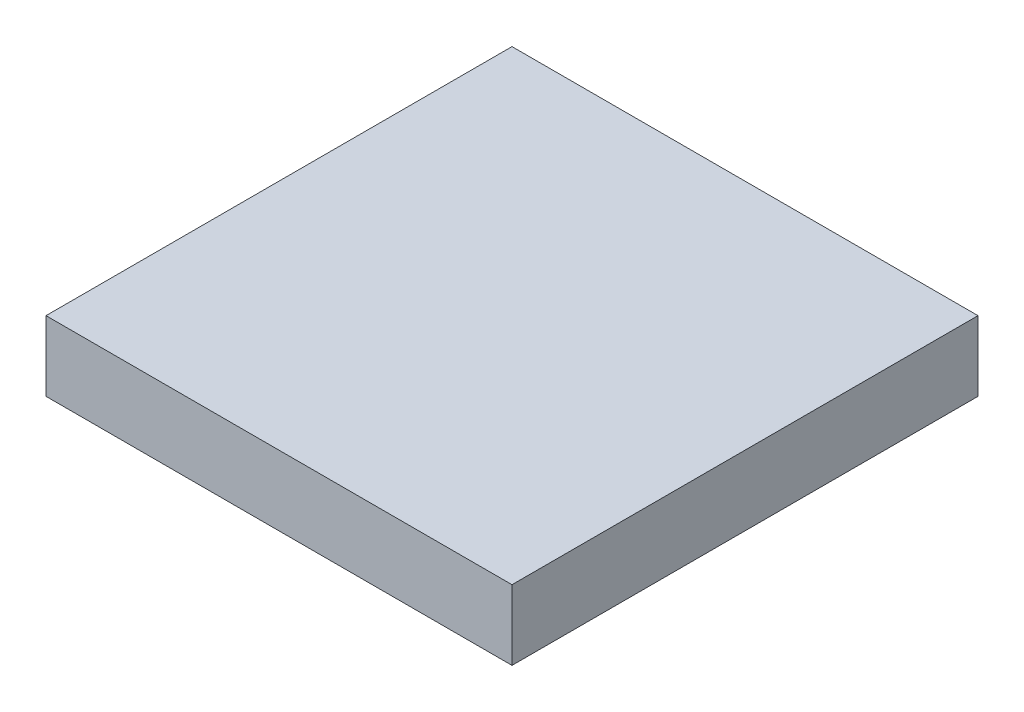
SolidWorks part; units mm, degrees
ref_plane "Front" through (0, 0, 0) normal (0, 0, 1) x (1, 0, 0)
ref_plane "Top" through (0, 0, 0) normal (0, 1, 0) x (1, 0, 0)
ref_plane "Right" through (0, 0, 0) normal (1, 0, 0) x (0, 0, -1)
body saved out of another part "Stock-prototype-1"
